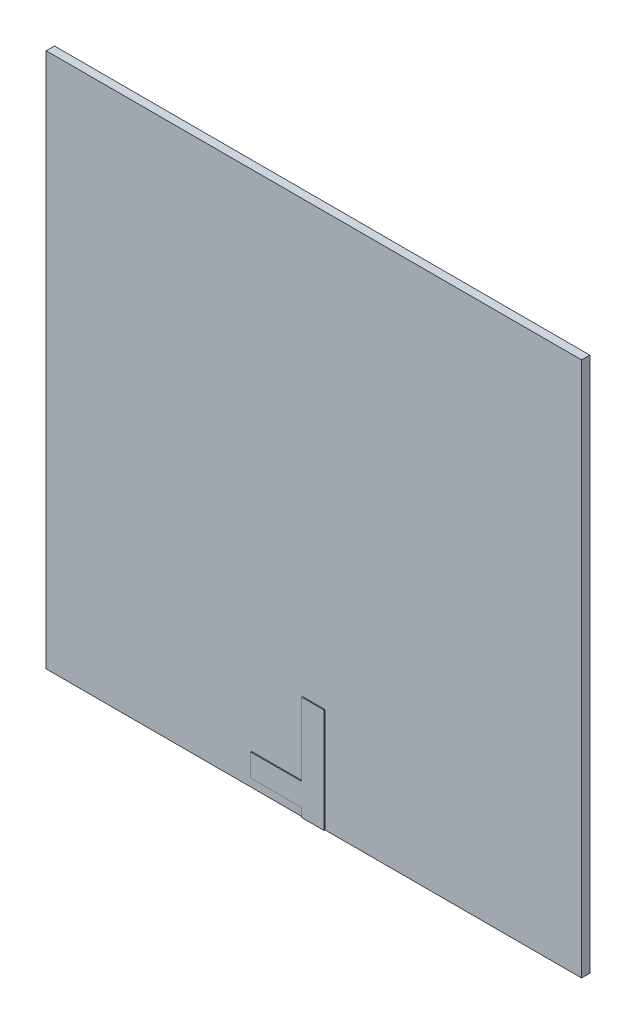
SolidWorks part; units mm, degrees
ref_plane "Alzado" through (0, 0, 0) normal (0, 0, 1) x (1, 0, 0)
ref_plane "Planta" through (0, 0, 0) normal (0, 1, 0) x (1, 0, 0)
ref_plane "Vista lateral" through (0, 0, 0) normal (1, 0, 0) x (0, 0, -1)
sketch "Croquis1" plane through (0, 0, 0) normal (0, 0, 1) x (1, 0, 0)
  line L0 (55, 0) -> (-55, 0) construction
  line L1 (-55, 55) -> (55, 55)
  line L2 (-55, 55) -> (-55, -55)
  line L3 (-55, -55) -> (55, -55)
  line L4 (55, 55) -> (55, -55)
  line L5 (0, -55) -> (0, 55) construction
  dimension "D1" = 110
  dimension "D2" = 110
  dimension "D3" = 55
  dimension "D4" = 55
extrude "Saliente-Extruir1" add sketch "Croquis1" along normal blind 1.9
sketch "Croquis6" plane through (0, 0, 1.9) normal (0, 0, 1) x (1, 0, 0)
  line L0 (-2.315, -55) -> (-2.315, -53.205)
  line L1 (-55, -55) -> (55, -55) construction
  line L2 (-2.315, -53.205) -> (-12.815, -53.205)
  line L3 (-12.815, -53.205) -> (-12.815, -48.575)
  line L4 (-12.815, -48.575) -> (-2.315, -48.575)
  line L5 (-2.315, -48.575) -> (-2.315, -33.575)
  line L6 (-2.315, -33.575) -> (2.315, -33.575)
  line L7 (2.315, -33.575) -> (2.315, -50.9)
  line L8 (2.315, -50.9) -> (2.315, -55)
  line L9 (2.315, -55) -> (-2.315, -55)
  line L10 (0, -1.595) -> (0, 1.595) construction
  point P4 (0, -33.575)
  dimension "D1" = 1.795
  dimension "D2" = 4.1
  dimension "D3" = 4.63
  dimension "D4" = 4.63
  dimension "D5" = 10.5
  dimension "D6" = 10.5
  dimension "D7" = 15
  dimension "D8" = 0
sketch "Croquis7" plane through (0, 0, 1.9) normal (0, 0, 1) x (1, 0, 0)
  line L0 (-2.315, -55) -> (-55, -55)
  line L1 (-55, -55) -> (-55, 55)
  line L2 (-55, 55) -> (55, 55)
  line L3 (55, 55) -> (55, -55)
  line L4 (55, -55) -> (2.315, -55)
  line L5 (2.315, -55) -> (2.315, -33.575)
  line L6 (2.315, -33.575) -> (-2.315, -33.575)
  line L7 (-2.315, -33.575) -> (-2.315, -48.575)
  line L8 (-2.315, -48.575) -> (-12.815, -48.575)
  line L9 (-12.815, -48.575) -> (-12.815, -53.205)
  line L10 (-12.815, -53.205) -> (-2.315, -53.205)
  line L11 (-2.315, -53.205) -> (-2.315, -55)
extrude "Cortar-Extruir1" cut sketch "Croquis7" against normal blind 0.2
